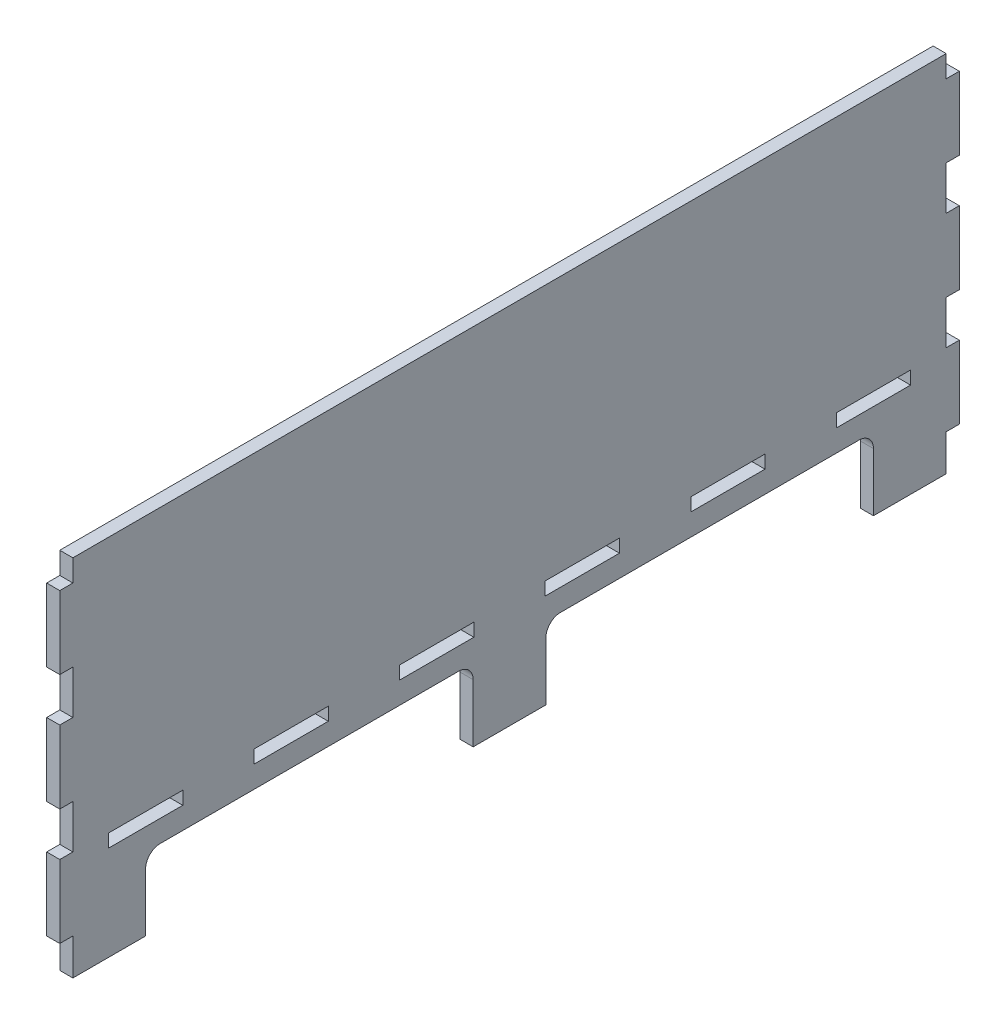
SolidWorks part; units mm, degrees
ref_plane "Front Plane" through (0, 0, 0) normal (0, 0, 1) x (1, 0, 0)
ref_plane "Top Plane" through (0, 0, 0) normal (0, 1, 0) x (1, 0, 0)
ref_plane "Right Plane" through (0, 0, 0) normal (1, 0, 0) x (0, 0, -1)
sketch "Sketch1" plane through (0, 0, 0) normal (1, 0, 0) x (0, 0, -1)
  line L0 (-300, -264.3326) -> (-300, -289.3326)
  line L1 (-300, -39.3326) -> (300, -39.3326)
  line L2 (-300, -39.3326) -> (-300, -54.3326)
  line L3 (-240, -239.3326) -> (-35, -239.3326)
  line L4 (300, -39.3326) -> (300, -54.3326)
  line L5 (-300, -289.3326) -> (-250, -289.3326)
  line L6 (-250, -289.3326) -> (-250, -249.3326)
  line L7 (300, -264.3326) -> (309, -264.3326)
  line L8 (-25, -249.3326) -> (-25, -289.3326)
  line L9 (25, -289.3326) -> (25, -249.3326)
  line L10 (-25, -289.3326) -> (25, -289.3326)
  line L11 (250, -249.3326) -> (250, -289.3326)
  line L12 (309, -264.3326) -> (309, -214.3326)
  line L13 (250, -289.3326) -> (300, -289.3326)
  line L14 (35, -239.3326) -> (240, -239.3326)
  line L15 (-300, -264.3326) -> (-309, -264.3326)
  line L16 (-309, -264.3326) -> (-309, -214.3326)
  line L17 (-309, -214.3326) -> (-300, -214.3326)
  line L18 (-309, -184.3326) -> (-309, -134.3326)
  line L19 (-309, -134.3326) -> (-300, -134.3326)
  line L20 (-300, -184.3326) -> (-309, -184.3326)
  line L21 (-309, -104.3326) -> (-309, -54.3326)
  line L22 (-309, -54.3326) -> (-300, -54.3326)
  line L23 (-300, -104.3326) -> (-309, -104.3326)
  line L24 (309, -214.3326) -> (300, -214.3326)
  line L25 (309, -134.3326) -> (300, -134.3326)
  line L26 (300, -289.3326) -> (300, -214.3326)
  line L27 (309, -184.3326) -> (309, -134.3326)
  line L28 (300, -184.3326) -> (309, -184.3326)
  line L29 (309, -54.3326) -> (300, -54.3326)
  line L30 (309, -104.3326) -> (309, -54.3326)
  line L31 (300, -104.3326) -> (309, -104.3326)
  line L32 (300, -264.3326) -> (300, -289.3326)
  line L33 (300, -184.3326) -> (300, -214.3326)
  line L34 (300, -104.3326) -> (300, -134.3326)
  line L35 (-300, -184.3326) -> (-300, -214.3326)
  line L36 (-300, -104.3326) -> (-300, -134.3326)
  arc A0 (-35, -239.3326) -> (-25, -249.3326) centre (-35, -249.3326) cw
  arc A1 (-240, -239.3326) -> (-250, -249.3326) centre (-240, -249.3326) ccw
  arc A2 (25, -249.3326) -> (35, -239.3326) centre (35, -249.3326) cw
  arc A3 (240, -239.3326) -> (250, -249.3326) centre (240, -249.3326) cw
  dimension "D2" = 10
  dimension "D3" = 10
  dimension "D5" = 10
  dimension "D7" = 10
  dimension "D4" = 50
  dimension "D8" = 9
  dimension "D9" = 50
  dimension "D10" = 25
  dimension "D11" = 250
  dimension "D12" = 600
  dimension "D13" = 50
  dimension "D15" = 25
  dimension "D16" = 50
  dimension "D17" = 9
  dimension "D6" = 3
  dimension "D14" = 3
  dimension "D18" = 3
extrude "Boss-Extrude1" add sketch "Sketch1" along normal blind 9
sketch "Sketch2" plane through (9, 0, 0) normal (1, 0, 0) x (0, 0, -1)
  line L0 (-240, -239.3326) -> (-35, -239.3326) construction
  line L1 (-275.5, -215.3326) -> (-224.5, -215.3326)
  line L2 (-275.5, -215.3326) -> (-275.5, -224.3326)
  line L3 (-275.5, -224.3326) -> (-224.5, -224.3326)
  line L4 (-224.5, -215.3326) -> (-224.5, -224.3326)
  dimension "D1" = 51
  dimension "D2" = 9
  dimension "D3" = 15
  dimension "D4" = 24.5
extrude "Cut-Extrude1" cut sketch "Sketch2" against normal through all
pattern_linear "LPattern1" count 6 spacing 100 along (0, 0, -1) of "Cut-Extrude1"
